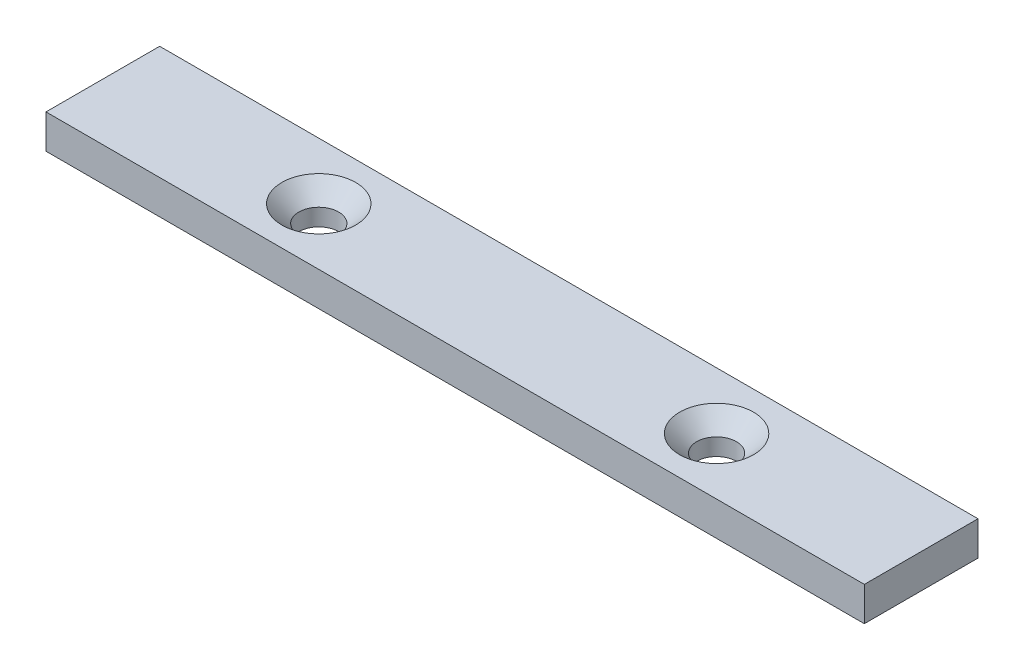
SolidWorks part; units mm, degrees
ref_plane "Front" through (0, 0, 0) normal (0, 0, 1) x (1, 0, 0)
ref_plane "Top" through (0, 0, 0) normal (0, 1, 0) x (1, 0, 0)
ref_plane "Right" through (0, 0, 0) normal (1, 0, 0) x (0, 0, -1)
sketch "Sketch1" plane through (0, 0, 0) normal (0, 1, 0) x (1, 0, 0)
  line L0 (-72, -10) -> (-72, 10)
  line L1 (-72, 10) -> (72, 10)
  line L2 (72, -10) -> (-72, 10) construction
  line L3 (-72, -10) -> (72, -10)
  line L4 (72, 10) -> (72, -10)
  dimension "D1" = 144
  dimension "D2" = 20
extrude "Extrude1" add sketch "Sketch1" along normal blind 6
sketch "Sketch2" plane through (0, 0, 0) normal (0, 0, 1) x (1, 0, 0)
  line L0 (-34, 9.9612) -> (-34, -7.174) construction
  line L1 (-40.5, 6) -> (-37.5, 3)
  line L2 (-72, 6) -> (72, 6) construction
  line L3 (-37.5, 3) -> (-37.5, 0)
  line L4 (-72, 0) -> (72, 0) construction
  line L5 (-37.5, 0) -> (-34, 0)
  line L6 (-34, 0) -> (-34, 6)
  line L7 (-34, 6) -> (-40.5, 6)
  line L8 (-72, 6) -> (-72, 0) construction
  dimension "D2" = 7
  dimension "D3" = 3
  dimension "D4" = 45
  dimension "D5" = 38
revolve "Cut-Revolve1" cut sketch "Sketch2" angle 360 about L0
pattern_linear "LPattern1" count 2 spacing 70
